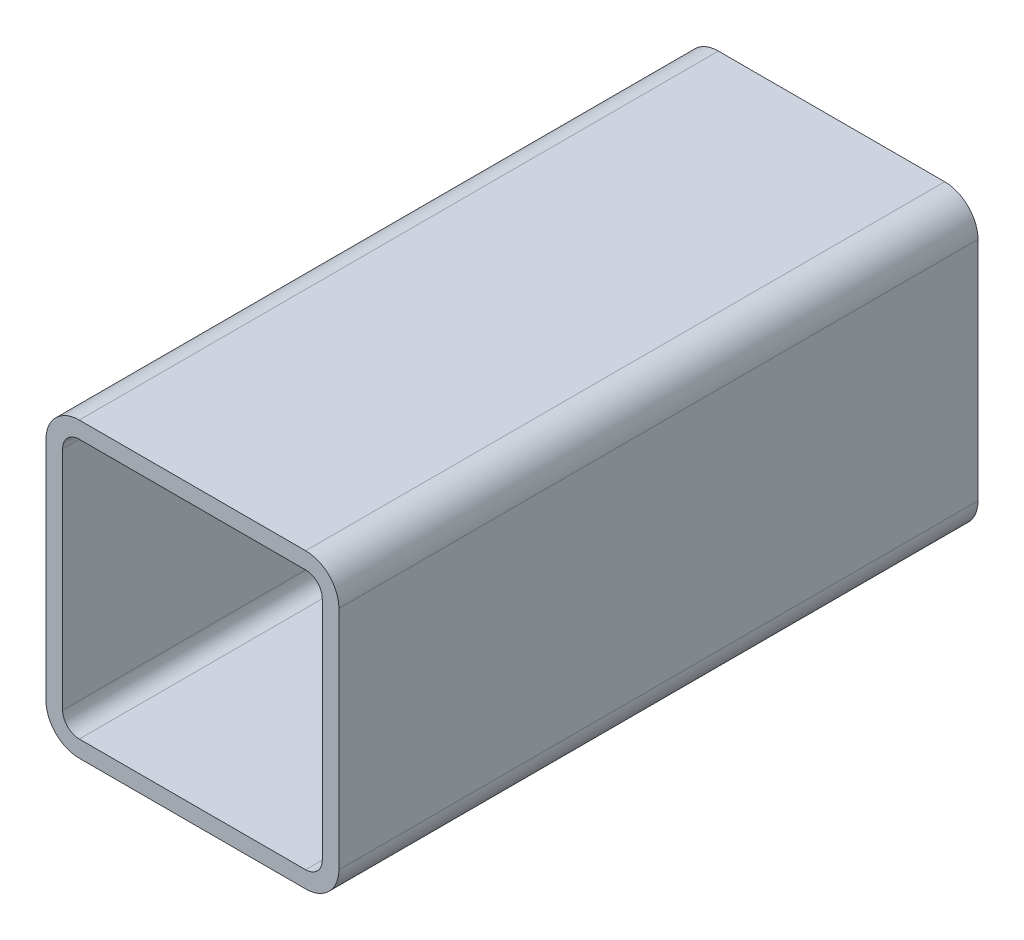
SolidWorks part; units mm, degrees
ref_plane "Front Plane" through (0, 0, 0) normal (0, 0, 1) x (1, 0, 0)
ref_plane "Top Plane" through (0, 0, 0) normal (0, 1, 0) x (1, 0, 0)
ref_plane "Right Plane" through (0, 0, 0) normal (1, 0, 0) x (0, 0, -1)
sketch "Sketch1" plane through (0, 0, 0) normal (0, 0, 1) x (1, 0, 0)
sketch_block_instance "HSS5.5x5.5x0.3125-1"
sketch_block "HSS5.5x5.5x0.3125"
extrude "Boss-Extrude1" add sketch "Sketch1" along normal blind 304.8
